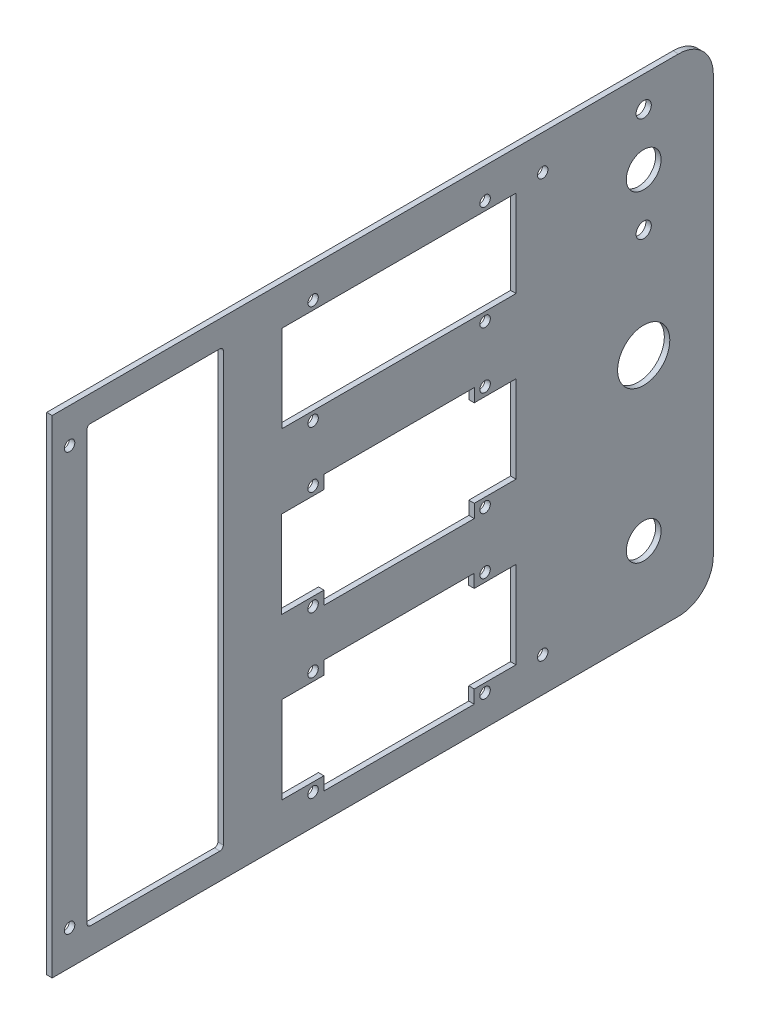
SolidWorks part; units mm, degrees
ref_plane "Front Plane" through (0, 0, 0) normal (0, 0, 1) x (1, 0, 0)
ref_plane "Top Plane" through (0, 0, 0) normal (0, 1, 0) x (1, 0, 0)
ref_plane "Right Plane" through (0, 0, 0) normal (1, 0, 0) x (0, 0, -1)
imported_body "Imported3"
sketch "Sketch24" plane through (907.5363, 0, 0) normal (1, 0, 0) x (0, 0, -1)
  line L3 (-766.2647, 478.6339) -> (-766.2647, 656.4339) construction
  line L5 (-766.2647, 478.6339) -> (-728.1647, 478.6339)
  line L6 (-766.2647, 478.6339) -> (-766.2647, 656.4339)
  line L7 (-942.7946, 488.1589) -> (-895.5506, 488.1589)
  line L8 (-894.2806, 489.4289) -> (-894.2806, 645.6389)
  line L9 (-895.5506, 646.9089) -> (-942.7946, 646.9089)
  line L10 (-857.5784, 583.4092) -> (-873.0638, 583.4092)
  line L11 (-873.0638, 551.6589) -> (-873.0638, 583.4092)
  line L12 (-802.7134, 588.2349) -> (-857.5784, 588.2349)
  line L13 (-857.5784, 588.2349) -> (-857.5784, 583.4092)
  line L14 (-787.4734, 583.4092) -> (-802.7134, 583.4092)
  line L15 (-802.7134, 583.4092) -> (-802.7134, 588.2349)
  line L17 (-787.4658, 551.6589) -> (-802.7115, 551.6562)
  line L18 (-802.7115, 551.6562) -> (-802.7115, 546.8329)
  line L19 (-802.7115, 546.8329) -> (-857.5784, 546.8329)
  line L20 (-857.5784, 546.8329) -> (-857.5784, 551.6589)
  line L21 (-857.5784, 551.6589) -> (-873.0638, 551.6589)
  line L23 (-857.5889, 492.9853) -> (-872.8289, 492.9853)
  line L24 (-802.7219, 488.1593) -> (-857.5889, 488.1593)
  line L25 (-802.7239, 529.5613) -> (-857.5889, 529.5613)
  line L26 (-857.5889, 524.7356) -> (-872.8289, 524.7356)
  line L27 (-857.5889, 529.5613) -> (-857.5889, 524.7356)
  line L28 (-872.8289, 492.9853) -> (-872.8289, 524.7356)
  line L29 (-802.7239, 524.7356) -> (-802.7239, 529.5613)
  line L30 (-787.4839, 524.7356) -> (-802.7239, 524.7356)
  line L31 (-787.4819, 492.9853) -> (-802.7219, 492.9853)
  line L32 (-802.7219, 492.9853) -> (-802.7219, 488.1593)
  line L33 (-857.5889, 488.1593) -> (-857.5889, 492.9853)
  line L34 (-872.8079, 610.3328) -> (-872.8079, 642.0831)
  line L35 (-857.5679, 642.0831) -> (-872.8079, 642.0831)
  line L37 (-787.4629, 642.0831) -> (-802.7029, 642.0831)
  line L39 (-787.461, 610.3328) -> (-802.701, 610.3328)
  line L42 (-857.5679, 610.3328) -> (-872.8079, 610.3328)
  line L43 (-853.0265, 1006.6617) -> (-863.5566, 996.9724)
  line L44 (-863.5566, 996.9724) -> (-865.1657, 995.4091)
  line L45 (-865.1657, 995.4091) -> (-885.7523, 973.1495)
  line L46 (-885.7523, 973.1495) -> (-887.2237, 971.377)
  line L47 (-887.2237, 971.377) -> (-896.3096, 959.7875)
  line L48 (-896.3096, 959.7875) -> (-904.0256, 948.9546)
  line L49 (-904.0256, 948.9546) -> (-919.8046, 923.064)
  line L50 (-919.8046, 923.064) -> (-922.9859, 917.0477)
  line L51 (-922.9859, 917.0477) -> (-932.9332, 895.7338)
  line L52 (-932.9332, 895.7338) -> (-934.7132, 891.4084)
  line L53 (-934.7132, 891.4084) -> (-942.3243, 870.2883)
  line L54 (-942.3243, 870.2883) -> (-943.2817, 867.2344)
  line L55 (-943.2817, 867.2344) -> (-950.7474, 837.8479)
  line L56 (-950.7474, 837.8479) -> (-955.2566, 807.8651)
  line L57 (-955.2566, 807.8651) -> (-956.7646, 777.5826)
  line L58 (-956.7646, 777.5826) -> (-956.7646, 357.4852)
  line L59 (-956.7646, 357.4852) -> (-955.2566, 327.2027)
  line L60 (-955.2566, 327.2027) -> (-950.7474, 297.2199)
  line L61 (-950.7474, 297.2199) -> (-943.2817, 267.8334)
  line L62 (-943.2817, 267.8334) -> (-942.3243, 264.7796)
  line L63 (-942.3243, 264.7796) -> (-934.7132, 243.6594)
  line L64 (-934.7132, 243.6594) -> (-932.9332, 239.3341)
  line L65 (-932.9332, 239.3341) -> (-919.8046, 212.0039)
  line L66 (-919.8046, 212.0039) -> (-914.9366, 203.3787)
  line L67 (-914.9366, 203.3787) -> (-904.0256, 186.1132)
  line L68 (-904.0256, 186.1132) -> (-896.3096, 175.2803)
  line L69 (-896.3096, 175.2803) -> (-887.2237, 163.6908)
  line L70 (-887.2237, 163.6908) -> (-885.7523, 161.9184)
  line L71 (-885.7523, 161.9184) -> (-865.1657, 139.6587)
  line L72 (-865.1657, 139.6587) -> (-863.5566, 138.0954)
  line L73 (-863.5566, 138.0954) -> (-853.0265, 128.4062)
  line L74 (-853.0265, 128.4062) -> (-842.4693, 119.5545)
  line L75 (-842.4693, 119.5545) -> (-817.888, 101.8047)
  line L76 (-817.888, 101.8047) -> (-812.6938, 98.508)
  line L77 (-812.6938, 98.508) -> (-796.6892, 89.2356)
  line L78 (-796.6892, 89.2356) -> (-791.6647, 86.5849)
  line L79 (-791.6647, 86.5849) -> (-767.8712, 86.5849)
  line L80 (-767.8712, 86.5849) -> (-767.8712, 1048.4829)
  line L81 (-767.8712, 1048.4829) -> (-791.6647, 1048.4829)
  line L82 (-791.6647, 1048.4829) -> (-812.6938, 1036.5598)
  line L83 (-812.6938, 1036.5598) -> (-817.888, 1033.2631)
  line L84 (-817.888, 1033.2631) -> (-842.4693, 1015.5133)
  line L85 (-842.4693, 1015.5133) -> (-853.0265, 1006.6617)
  line L101 (-956.7646, 656.4339) -> (-956.7646, 478.6339)
  line L131 (-857.5679, 610.3328) -> (-802.701, 610.3328)
  line L132 (-857.5679, 642.0831) -> (-802.7029, 642.0831)
  line L137 (-787.4686, 610.3328) -> (-787.4629, 642.0831)
  line L141 (-787.4734, 551.6589) -> (-787.4734, 583.4092)
  line L142 (-787.4896, 492.9853) -> (-787.4839, 524.7356)
  line L144 (-944.0646, 489.4289) -> (-944.0646, 645.6389)
  line L147 (-956.7646, 478.6339) -> (-766.2647, 478.6339)
  line L148 (-956.7646, 656.4339) -> (-766.2647, 656.4339)
  line L153 (-766.2647, 656.4339) -> (-728.1647, 656.4339)
  line L154 (-715.4647, 491.3339) -> (-715.4647, 643.7339)
  circle A9 centre (-861.5393, 548.4839) radius 1.905
  circle A10 centre (-861.5393, 586.5839) radius 1.905
  circle A11 centre (-798.7505, 548.4839) radius 1.905
  circle A12 centre (-798.7505, 586.5839) radius 1.905
  circle A13 centre (-861.55, 527.9099) radius 1.905
  circle A14 centre (-798.7612, 527.9099) radius 1.905
  circle A15 centre (-798.7612, 489.8099) radius 1.905
  circle A16 centre (-861.55, 489.8099) radius 1.905
  circle A17 centre (-861.5286, 607.1579) radius 1.905
  circle A18 centre (-861.5286, 645.2579) radius 1.905
  circle A19 centre (-798.7398, 645.2579) radius 1.905
  circle A20 centre (-798.7398, 607.1579) radius 1.905
  circle A61 centre (-950.4147, 643.7339) radius 1.905
  circle A62 centre (-950.4147, 491.3339) radius 1.905
  circle A63 centre (-777.7175, 491.3339) radius 1.905
  circle A64 centre (-777.7175, 643.7339) radius 1.905
  arc A69 (-895.5506, 488.1589) -> (-894.2806, 489.4289) centre (-895.5506, 489.4289) ccw
  arc A70 (-894.2806, 645.6389) -> (-895.5506, 646.9089) centre (-895.5506, 645.6389) ccw
  arc A71 (-942.7946, 646.9089) -> (-944.0646, 645.6389) centre (-942.7946, 645.6389) ccw
  arc A72 (-942.7946, 488.1589) -> (-944.0646, 489.4289) centre (-942.7946, 489.4289) cw
  circle A74 centre (-740.8647, 567.5339) radius 9.525
  circle A75 centre (-740.8647, 508.8604) radius 6.35
  circle A76 centre (-740.8647, 626.2079) radius 6.35
  arc A77 (-728.1647, 656.4339) -> (-715.4647, 643.7339) centre (-728.1647, 643.7339) cw
  arc A78 (-728.1647, 478.6339) -> (-715.4647, 491.3339) centre (-728.1647, 491.3339) ccw
  circle A79 centre (-740.8647, 645.2579) radius 2.7781
  circle A80 centre (-740.8647, 607.1579) radius 2.7781
  point P54 (-944.0646, 567.5339)
  point P216 (-777.7175, 491.3339)
  point P217 (-777.7175, 643.7339)
  point P232 (-857.5889, 527.1484)
  point P243 (-894.2806, 646.9089)
  point P245 (-950.4147, 643.7339)
  point P246 (-950.4147, 491.3339)
  point P248 (-944.0646, 646.9089)
  point P251 (-944.0646, 488.1589)
  point P259 (-787.4868, 508.8604)
  point P260 (-787.4658, 626.2079)
  dimension "D6" = 241.3
  dimension "D29" = 3.81
  dimension "D30" = 3.81
  dimension "D39" = 158.75
  dimension "D41" = 1.27
  dimension "D50" = 12.7
  dimension "D5" = 177.8
  dimension "D18" = 38.1
  dimension "D19" = 54.8649
  dimension "D20" = 85.598
  dimension "D21" = 41.402
  dimension "D22" = 31.7503
  dimension "D23" = 62.7888
  dimension "D24" = 15.24
  dimension "D25" = 31.7503
  dimension "D26" = 85.3469
  dimension "D27" = 38.1
  dimension "D28" = 62.7888
  dimension "D32" = 31.7503
  dimension "D33" = 62.7888
  dimension "D34" = 85.3469
  dimension "D35" = 54.8649
  dimension "D36" = 15.24
  dimension "D37" = 38.1
  dimension "D40" = 49.784
  dimension "D1" = 0
extrude "Boss-Extrude2" add sketch "Sketch24" along normal blind 2 separate body
